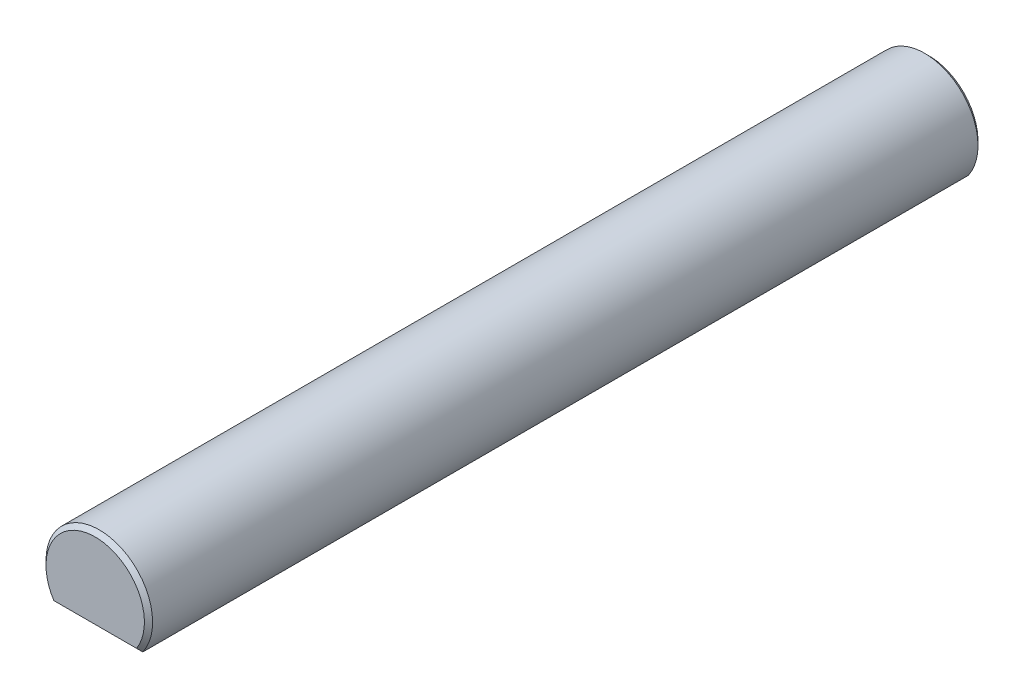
SolidWorks part; units mm, degrees
ref_plane "Front Plane" through (0, 0, 0) normal (0, 0, 1) x (1, 0, 0)
ref_plane "Top Plane" through (0, 0, 0) normal (0, 1, 0) x (1, 0, 0)
ref_plane "Right Plane" through (0, 0, 0) normal (1, 0, 0) x (0, 0, -1)
sketch "Sketch1" plane through (0, 0, 0) normal (0, 0, 1) x (1, 0, 0)
  line L0 (-6.371, -4.5) -> (6.371, -4.5)
  arc A0 (6.371, -4.5) -> (-6.371, -4.5) centre (0, 0) ccw
  dimension "D1" = 15.6
  dimension "D2" = 4.5
extrude "Boss-Extrude1" add sketch "Sketch1" along normal blind 122
chamfer "Chamfer1" distance 0.6 angle 45 4 edges at (0, 7.8, 0) (0, 7.8, 122) (0, -4.5, 0) (0, -4.5, 122)
